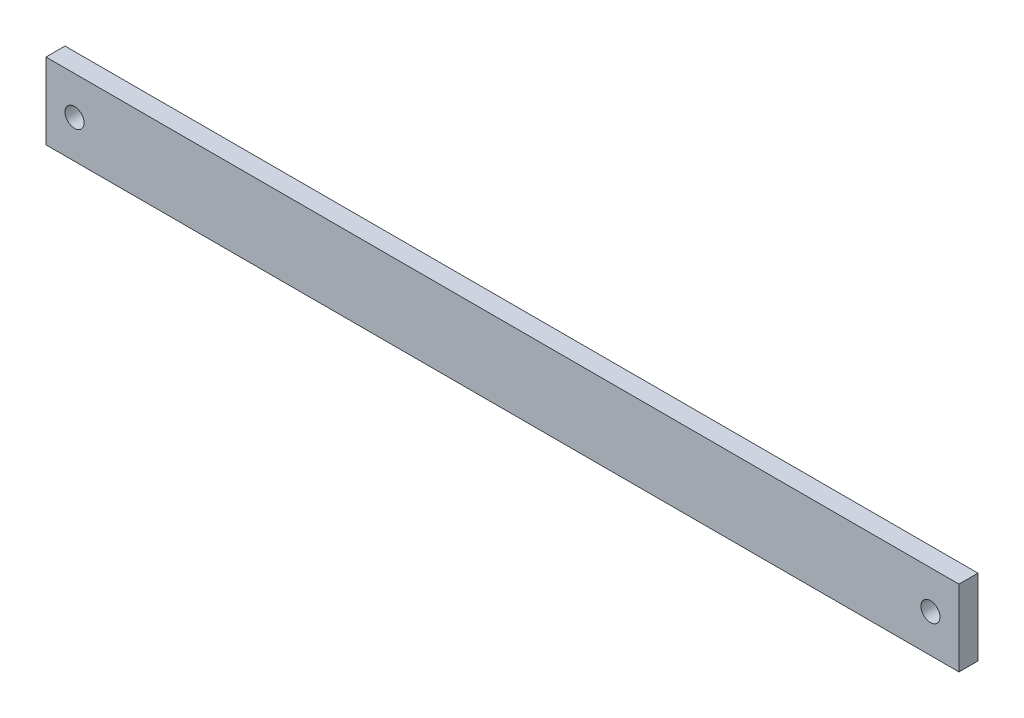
SolidWorks part; units mm, degrees
ref_plane "Front Plane" through (0, 0, 0) normal (0, 0, 1) x (1, 0, 0)
ref_plane "Top Plane" through (0, 0, 0) normal (0, 1, 0) x (1, 0, 0)
ref_plane "Right Plane" through (0, 0, 0) normal (1, 0, 0) x (0, 0, -1)
sketch "Sketch1" plane through (0, 0, 0) normal (0, 0, 1) x (1, 0, 0)
  line L0 (0, 0) -> (0, 282.575) construction
  line L1 (-152.4, 307.975) -> (152.4, 307.975)
  line L2 (-152.4, 307.975) -> (-152.4, 282.575)
  line L3 (-152.4, 282.575) -> (152.4, 282.575)
  line L4 (152.4, 307.975) -> (152.4, 282.575)
  line L6 (120.65, 304.8) -> (-120.65, 304.8) construction
  dimension "D1" = 304.8
  dimension "D2" = 25.4
  dimension "D3" = 3.175
extrude "Extrude1" add sketch "Sketch1" along normal blind 6.35
sketch "Sketch2" plane through (0, 0, 6.35) normal (0, 0, 1) x (1, 0, 0)
  line L0 (0, 282.575) -> (0, 362.1519) construction
  line L1 (-152.4, 282.575) -> (152.4, 282.575) construction
  line L2 (152.4, 295.275) -> (142.875, 295.275) construction
  line L3 (152.4, 282.575) -> (152.4, 307.975) construction
  circle A0 centre (142.875, 295.275) radius 3.175
  circle A1 centre (-142.875, 295.275) radius 3.175
  dimension "D1" = 6.35
  dimension "D2" = 9.525
extrude "Cut-Extrude1" cut sketch "Sketch2" against normal through all
